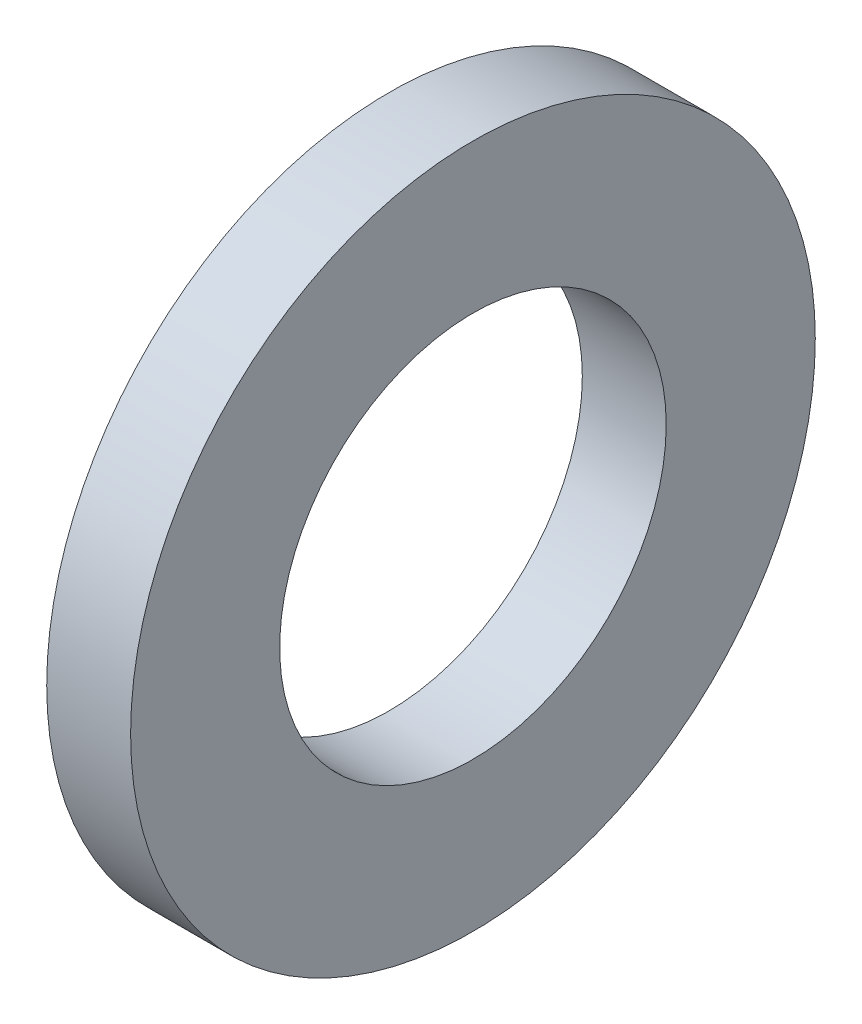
SolidWorks part; units mm, degrees
ref_plane "Front Plane" through (0, 0, 0) normal (0, 0, 1) x (1, 0, 0)
ref_plane "Top Plane" through (0, 0, 0) normal (0, 1, 0) x (1, 0, 0)
ref_plane "Right Plane" through (0, 0, 0) normal (1, 0, 0) x (0, 0, -1)
sketch "Sketch1" plane through (0, 0, 0) normal (1, 0, 0) x (0, 0, -1)
  circle A0 centre (0, 0) radius 5.8039
  circle A1 centre (0, 0) radius 3.2766
  dimension "D1" = 11.6078
  dimension "D2" = 6.5532
extrude "Boss-Extrude1" add sketch "Sketch1" along normal blind 1.4224
